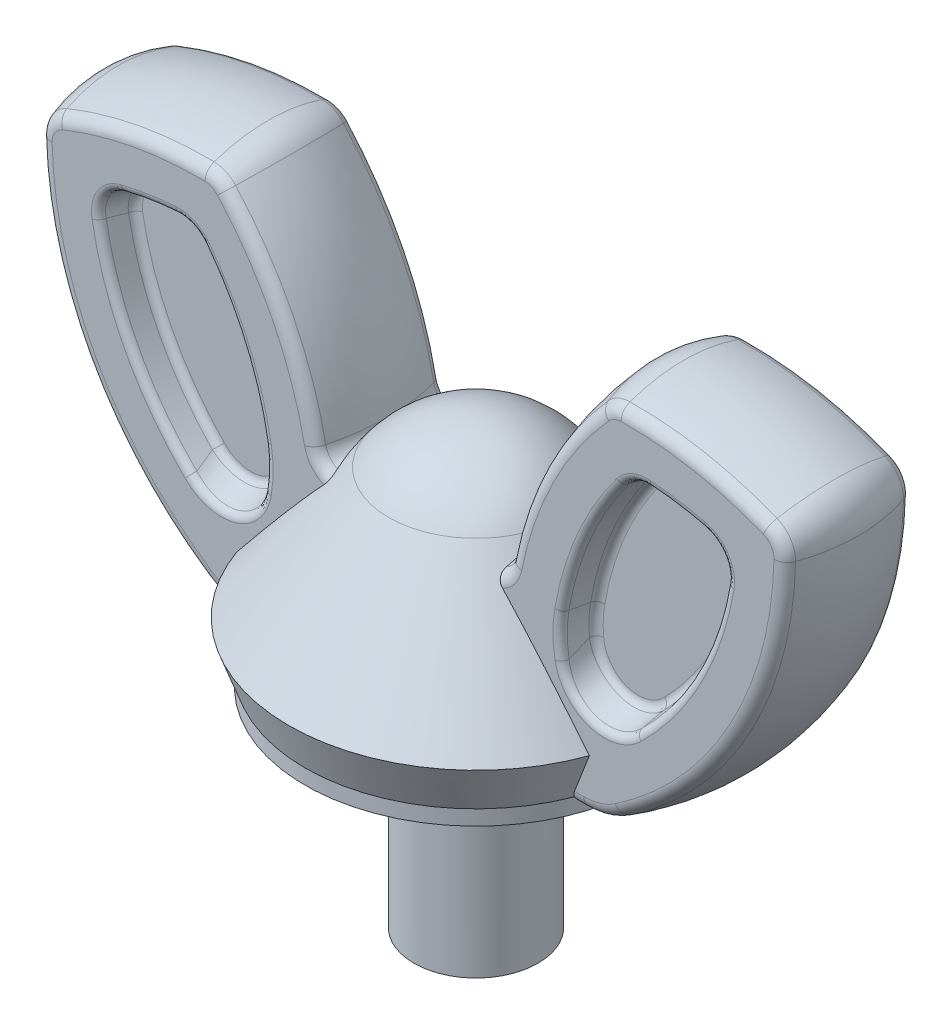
SolidWorks part; units mm, degrees
ref_plane "Front Plane" through (0, 0, 0) normal (0, 0, 1) x (1, 0, 0)
ref_plane "Top Plane" through (0, 0, 0) normal (0, 1, 0) x (1, 0, 0)
ref_plane "Right Plane" through (0, 0, 0) normal (1, 0, 0) x (0, 0, -1)
sketch "Sketch1" plane through (0, 0, 0) normal (0, 0, 1) x (1, 0, 0)
  line L0 (0, 10.7344) -> (0, 0) construction
  line L5 (4.826, 0) -> (-4.826, 0)
  line L6 (2.413, 5.08) -> (-2.413, 5.08)
  arc A11 (-2.413, 5.08) -> (-5.3975, 10.9034) centre (-13.1787, 3.2391) ccw
  arc A13 (-5.3975, 10.9034) -> (-10.795, 9.8298) centre (-6.0342, 0) ccw
  arc A24 (-10.795, 9.8298) -> (-6.0486, 0.3742) centre (0, 9.3295) ccw
  arc A26 (-4.826, 0) -> (-6.0486, 0.3742) centre (-4.826, 2.1844) cw
  arc A29 (4.826, 0) -> (6.0486, 0.3742) centre (4.826, 2.1844) ccw
  arc A34 (10.795, 9.8298) -> (6.0486, 0.3742) centre (0, 9.3295) cw
  arc A36 (5.3975, 10.9034) -> (10.795, 9.8298) centre (6.0342, 0) cw
  arc A37 (2.413, 5.08) -> (5.3975, 10.9034) centre (13.1787, 3.2391) cw
  point P19 (0, 0)
  point P27 (0, 5.08)
  point P29 (0, 5.08)
  point P44 (0, 5.08)
  dimension "D2" = 2.1844
  dimension "D1" = 5.3975
  dimension "D3" = 9.8298
  dimension "D4" = 10.922
  dimension "B" = 10.922
  dimension "A" = 21.59
  dimension "E" = 9.652
  dimension "G" = 5.08
  dimension "D5" = 4.826
extrude "Extrude1" add sketch "Sketch1" along normal mid plane 3.556
fillet "Fillet4" radius 1.0922 4 edges at (10.795, 9.8298, 0) (5.3975, 10.9034, 0) (-5.3975, 10.9034, 0) (-10.795, 9.8298, 0)
sketch "Sketch2" plane through (0, 0, 1.778) normal (0, 0, 1) x (1, 0, 0)
  line L0 (0, 0) -> (0, 12.8329) construction
  line L1 (-4.826, 0) -> (4.826, 0) construction
  arc A10 (-4.1864, 4.7767) -> (-5.0416, 1.8652) centre (-7.5893, 4.1949) cw
  arc A11 (4.1864, 4.7767) -> (6.2055, 9.1212) centre (13.1787, 3.2391) cw
  arc A12 (6.2055, 9.1212) -> (8.9805, 8.634) centre (6.0342, 0) cw
  arc A13 (8.9805, 8.634) -> (5.0416, 1.8652) centre (0, 9.3295) cw
  arc A14 (4.1864, 4.7767) -> (5.0416, 1.8652) centre (7.5893, 4.1949) ccw
  arc A15 (-8.9805, 8.634) -> (-5.0416, 1.8652) centre (0, 9.3295) ccw
  arc A16 (-6.2055, 9.1212) -> (-8.9805, 8.634) centre (-6.0342, 0) ccw
  arc A17 (-4.1864, 4.7767) -> (-6.2055, 9.1212) centre (-13.1787, 3.2391) ccw
  arc A18 (-8.9805, 8.634) -> (-5.0416, 1.8652) centre (0, 9.3295) ccw
  arc A19 (-6.2055, 9.1212) -> (-8.9805, 8.634) centre (-6.0342, 0) ccw
  arc A20 (-4.1864, 4.7767) -> (-6.2055, 9.1212) centre (-13.1787, 3.2391) ccw
  dimension "D1" = 1.7992
extrude "Cut-Extrude1" cut sketch "Sketch2" against normal blind 0.889 draft 10
fillet "Fillet1" radius 0.889 4 edges
fillet "Fillet6" radius 1.2446 2 edges
fillet "Fillet5" radius 0.3641 2 edges at (2.413, 5.08, 0) (-2.413, 5.08, 0)
fillet "Fillet3" radius 0.2223 28 edges at (7.4585, 9.011, 1.778) (7.4007, 8.8613, 0.889) (6.4621, 8.9114, 0.889) (8.6146, 8.3041, 0.889) (7.8855, 5.3103, 0.889) (4.2988, 4.3764, 0.889) (6.1282, 8.9579, 1.778) (8.7221, 8.5339, 1.778) (7.9776, 5.1471, 1.778) (4.1377, 4.1292, 1.778) (-4.2988, 4.3764, 0.889) (-7.8855, 5.3103, 0.889) (-8.5332, 8.4279, 0.889) (-7.4007, 8.8613, 0.889) (-6.1942, 8.7899, 0.889) (-4.1377, 4.1292, 1.778) (-7.9776, 5.1471, 1.778) (-8.7866, 8.4358, 1.778) (-7.4585, 9.011, 1.778) (-6.3795, 9.0717, 1.778) (4.9351, 6.7652, 0.889) (4.81, 6.8709, 1.778) (-4.9351, 6.7652, 0.889) (-4.81, 6.8709, 1.778) (4.9742, 2.938, 0.889) (5.0791, 2.5366, 1.778) (-5.2102, 2.8514, 0.889) (-5.0131, 2.5568, 1.778)
mirror "Mirror1" about plane through (0, 0, 0) normal (0, 0, 1) of "Fillet6", "Fillet3", "Fillet1", "Cut-Extrude1"
sketch "Sketch4" plane through (0, 0, 0) normal (1, 0, 0) x (0, 0, -1)
  line L1 (-1.778, 5.334) -> (1.778, 5.334)
  line L2 (-1.778, 4.4704) -> (-1.778, 5.334)
  line L4 (1.778, 0.3742) -> (1.778, 9.0918) construction
  line L6 (-1.778, 9.0918) -> (-1.778, 0.3742) construction
  line L7 (0, 5.715) -> (0, 0.381) construction
  line L9 (1.778, 4.4704) -> (1.778, 5.334)
  line L10 (-1.778, 5.08) -> (1.778, 5.08) construction
  arc A0 (-1.524, 4.826) -> (-1.778, 4.4704) centre (-1.4021, 4.4704) ccw
  arc A1 (1.524, 4.826) -> (-1.524, 4.826) centre (0, 0.381) ccw
  arc A2 (1.524, 4.826) -> (1.778, 4.4704) centre (1.4021, 4.4704) cw
  point P8 (0, 5.08)
  dimension "D1" = 0.254
  dimension "D2" = 0.254
  dimension "D3" = 0.254
sketch3d "3DSketch1"
  line L2 (-2.1102, 5.08, 1.778) -> (2.1102, 5.08, 1.778)
  line L3 (4.826, 0, 1.778) -> (-4.826, 0, 1.778)
  line L4 (-2.1102, 5.08, 1.778) -> (2.1102, 5.08, 1.778)
  line L5 (4.826, 0, 1.778) -> (-4.826, 0, 1.778)
  arc A15 (10.804, 9.0918, 1.778) -> (6.0486, 0.3742, 1.778) centre (0, 9.3295, 1.778) ccw
  arc A16 (10.1207, 10.1287, 1.778) -> (10.804, 9.0918, 1.778) centre (9.712, 9.1158, 1.778) ccw
  arc A17 (5.8682, 10.9207, 1.778) -> (10.1207, 10.1287, 1.778) centre (6.0342, 0, 1.778) ccw
  arc A18 (5.0743, 10.5608, 1.778) -> (5.8682, 10.9207, 1.778) centre (5.8848, 9.8287, 1.778) ccw
  arc A19 (2.4672, 5.3729, 1.778) -> (5.0743, 10.5608, 1.778) centre (13.1787, 3.2391, 1.778) ccw
  arc A20 (2.1102, 5.08, 1.778) -> (2.4672, 5.3729, 1.778) centre (2.1102, 5.4441, 1.778) ccw
  arc A21 (2.1102, 5.08, 1.778) -> (2.4672, 5.3729, 1.778) centre (2.1102, 5.4441, 1.778) ccw
  arc A22 (-5.0743, 10.5608, 1.778) -> (-2.4672, 5.3729, 1.778) centre (-13.1787, 3.2391, 1.778) ccw
  arc A23 (-5.8682, 10.9207, 1.778) -> (-5.0743, 10.5608, 1.778) centre (-5.8848, 9.8287, 1.778) ccw
  arc A24 (-10.1207, 10.1287, 1.778) -> (-5.8682, 10.9207, 1.778) centre (-6.0342, 0, 1.778) ccw
  arc A25 (-10.804, 9.0918, 1.778) -> (-10.1207, 10.1287, 1.778) centre (-9.712, 9.1158, 1.778) ccw
  arc A26 (-6.0486, 0.3742, 1.778) -> (-10.804, 9.0918, 1.778) centre (0, 9.3295, 1.778) ccw
  arc A27 (-4.826, 0, 1.778) -> (-6.0486, 0.3742, 1.778) centre (-4.826, 2.1844, 1.778) ccw
  arc A28 (6.0486, 0.3742, 1.778) -> (4.826, 0, 1.778) centre (4.826, 2.1844, 1.778) ccw
  arc A29 (10.804, 9.0918, 1.778) -> (6.0486, 0.3742, 1.778) centre (0, 9.3295, 1.778) ccw
  arc A30 (10.1207, 10.1287, 1.778) -> (10.804, 9.0918, 1.778) centre (9.712, 9.1158, 1.778) ccw
  arc A31 (5.8682, 10.9207, 1.778) -> (10.1207, 10.1287, 1.778) centre (6.0342, 0, 1.778) ccw
  arc A32 (5.0743, 10.5608, 1.778) -> (5.8682, 10.9207, 1.778) centre (5.8848, 9.8287, 1.778) ccw
  arc A33 (2.4672, 5.3729, 1.778) -> (5.0743, 10.5608, 1.778) centre (13.1787, 3.2391, 1.778) ccw
  arc A34 (-2.4672, 5.3729, 1.778) -> (-2.1102, 5.08, 1.778) centre (-2.1102, 5.4441, 1.778) ccw
  arc A35 (-2.4672, 5.3729, 1.778) -> (-2.1102, 5.08, 1.778) centre (-2.1102, 5.4441, 1.778) ccw
  arc A36 (-5.0743, 10.5608, 1.778) -> (-2.4672, 5.3729, 1.778) centre (-13.1787, 3.2391, 1.778) ccw
  arc A37 (-5.8682, 10.9207, 1.778) -> (-5.0743, 10.5608, 1.778) centre (-5.8848, 9.8287, 1.778) ccw
  arc A38 (-10.1207, 10.1287, 1.778) -> (-5.8682, 10.9207, 1.778) centre (-6.0342, 0, 1.778) ccw
  arc A39 (-10.804, 9.0918, 1.778) -> (-10.1207, 10.1287, 1.778) centre (-9.712, 9.1158, 1.778) ccw
  arc A40 (-6.0486, 0.3742, 1.778) -> (-10.804, 9.0918, 1.778) centre (0, 9.3295, 1.778) ccw
  arc A41 (-4.826, 0, 1.778) -> (-6.0486, 0.3742, 1.778) centre (-4.826, 2.1844, 1.778) ccw
  arc A42 (6.0486, 0.3742, 1.778) -> (4.826, 0, 1.778) centre (4.826, 2.1844, 1.778) ccw
  point P3 (2.1102, 5.4441, 2.1421)
  point P5 (2.1102, 5.4441, 2.1421)
  point P11 (-2.1102, 5.4441, 2.1421)
  point P13 (-2.1102, 5.4441, 2.1421)
  point P43 (0, 9.3295, -9.0286)
  point P46 (9.712, 9.1158, 0.6858)
  point P48 (6.0342, 0, -9.144)
  point P50 (5.8848, 9.8287, 0.6858)
  point P52 (13.1787, 3.2391, -9.144)
  point P58 (-13.1787, 3.2391, -9.144)
  point P60 (-5.8848, 9.8287, 0.6858)
  point P62 (-6.0342, 0, -9.144)
  point P64 (-9.712, 9.1158, 0.6858)
  point P66 (0, 9.3295, -9.0286)
  point P68 (-4.826, 2.1844, -0.4064)
  point P70 (4.826, 2.1844, -0.4064)
  point P71 (0, 9.3295, -9.0286)
  point P72 (9.712, 9.1158, 0.6858)
  point P73 (6.0342, 0, -9.144)
  point P74 (5.8848, 9.8287, 0.6858)
  point P75 (13.1787, 3.2391, -9.144)
  point P78 (-13.1787, 3.2391, -9.144)
  point P79 (-5.8848, 9.8287, 0.6858)
  point P80 (-6.0342, 0, -9.144)
  point P81 (-9.712, 9.1158, 0.6858)
  point P82 (0, 9.3295, -9.0286)
  point P83 (-4.826, 2.1844, -0.4064)
  point P84 (4.826, 2.1844, -0.4064)
  dimension "D1" = 0
sweep "Cut-Sweep2" cut profiles "Sketch4" path "3DSketch1"
sketch "Sketch3" plane through (0, 0, 0) normal (0, 0, 1) x (1, 0, 0)
  line L0 (0, 6.5903) -> (0, -11.3525) construction
  line L1 (1.7526, 0) -> (4.826, 0)
  line L2 (5.2882, 1.6933) -> (2.4672, 5.3729)
  line L4 (1.7526, 0) -> (1.7526, -6.35)
  line L5 (1.7526, -6.35) -> (0, -6.35)
  line L6 (4.826, 0) -> (4.826, 0.4233)
  line L7 (0, 6.5903) -> (0, -6.35)
  line L8 (0, 6.5903) -> (-2.4754, 6.5903) construction
  line L9 (4.826, 0.4233) -> (5.2882, 1.6933)
  arc A1 (2.4672, 5.3729) -> (0, 6.5903) centre (0, 3.4814) ccw
  dimension "D2" = 1.27
  dimension "D3" = 9.652
  dimension "d1" = 3.5052
  dimension "D4" = 0.4233
  dimension "L" = 6.35
  dimension "D5" = 20
revolve "Revolve1" add sketch "Sketch3" angle 360 about L0
sketch "Sketch6" plane through (0, 0, 0) normal (0, 0, 1) x (1, 0, 0)
  line L0 (0, 4.5862) -> (0, -8.8633) construction
  line L2 (1.7526, -6.35) -> (1.7526, 0) construction
  line L3 (-1.7526, -6.35) -> (1.7526, -6.35) construction
  line L4 (1.7526, -5.8881) -> (2.0066, -5.8881)
  line L5 (2.0066, -5.8881) -> (2.0066, -6.604)
  line L8 (2.0066, -6.604) -> (0, -6.604)
  line L9 (0, -6.604) -> (0, -6.35)
  arc A0 (0, -6.35) -> (1.7526, -5.8881) centre (0, -2.794) ccw
  dimension "D1" = 0.254
  dimension "R" = 3.556
  dimension "D2" = 0.254
revolve "Cut-Revolve11" cut sketch "Sketch6" angle 360 about L0
sketch "Sketch5" plane through (0, 0, 0) normal (0, 0, 1) x (1, 0, 0)
  line L0 (1.7526, -0.0254) -> (1.2802, -0.2982)
  line L1 (1.2802, -0.2982) -> (1.7526, -0.5709)
  line L2 (1.7526, -0.5709) -> (1.7526, -0.0254)
  line L3 (0, 0) -> (0, -7.7715) construction
  line L6 (1.2802, -0.2982) -> (1.2802, -1.0906) construction
  dimension "D1" = 3.5052
  dimension "D2" = 2.5603
  dimension "D3" = 0.0254
  dimension "pitch" = 0.7925
revolve "Cut-Revolve10" [suppressed] cut sketch "Sketch5" angle 360 about L3
pattern_linear "LPattern10" [suppressed] count 8 spacing 0.7925 along (0, -1, 0)
equation "\"D5@Sketch1\" = \"E@Sketch1\" / 2"
equation "\"D1@Sketch1\" = \"A@Sketch1\" / 4"
equation "\"D3@Sketch1\" = \"B@Sketch1\" * 9 /  10"
equation "\"D4@Sketch1\" = \"B@Sketch1\""
equation "\"D2@Sketch1\" = \"D4@Sketch1\" / 5"
equation "\"D1@Cut-Extrude1\" = \"C@Extrude1\" / 4"
equation "\"D1@Fillet1\" = \"D1@Cut-Extrude1\""
equation "\"D1@Fillet3\" = \"D1@Cut-Extrude1\" / 4"
equation "\"D2@Sketch3\" = \"G@Sketch1\" / 4"
equation "\"D3@Sketch3\" = \"E@Sketch1\""
equation "\"D1@Sketch4\" = \"C@Extrude1\" / 14"
equation "\"D1@Sketch5\" = \"d1@Sketch3\""
equation "\"D2@Sketch5\" = \"THD_MINOR@Cosmetic Thread1\""
equation "\"D3@LPattern10\" = \"pitch@Sketch5\""
equation "\"D1@LPattern10\" = \"L@Sketch3\" / \"D3@LPattern10\""
equation "\"D1@Cosmetic Thread1\" = \"L@Sketch3\""
equation "\"D2@Sketch4\" = \"D1@Sketch4\""
equation "\"D4@Sketch3\" = \"D2@Sketch3\" / 3"
equation "\"D1@Fillet4\" = \"D2@Sketch1\" /2"
equation "\"D1@Sketch2\" = \"D1@Sketch1\" / 3"
equation "\"D1@Fillet5\" = \"D1@Fillet4\" / 3"
equation "\"D1@Fillet6\" = \"D1@Fillet1\" * 1.4"
